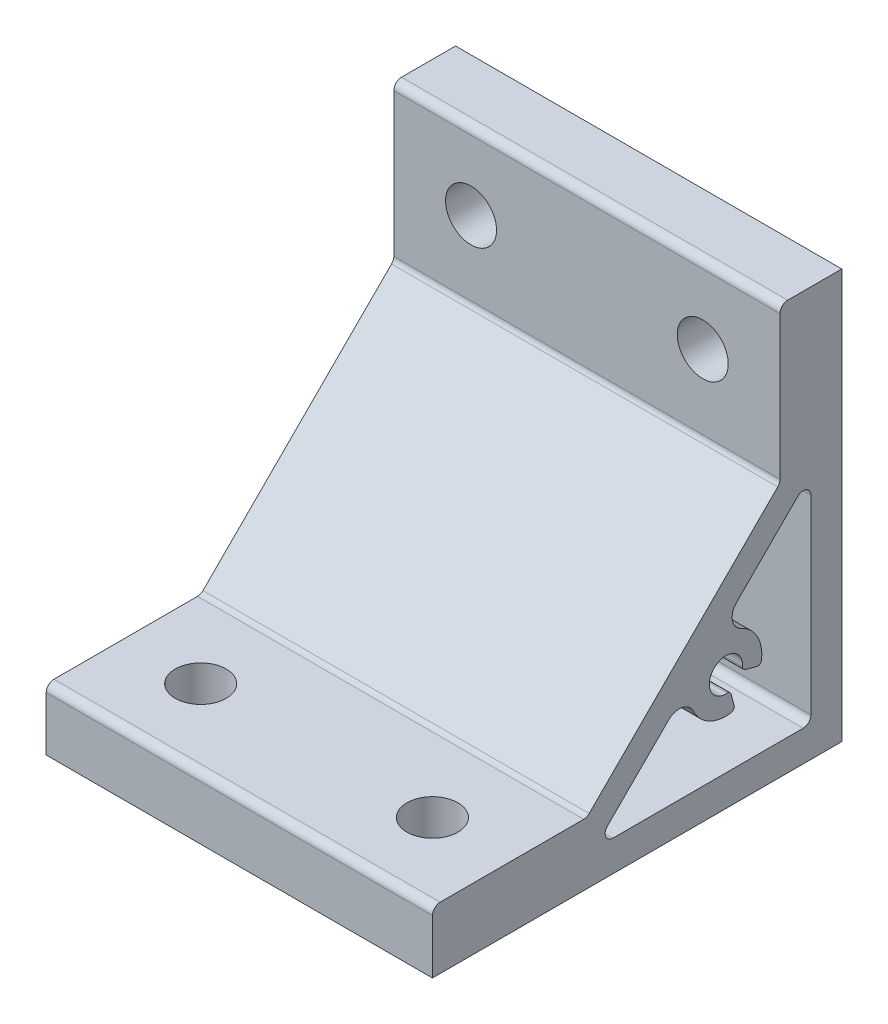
SolidWorks part; units mm, degrees
ref_plane "正面" through (0, 0, 0) normal (0, 0, 1) x (1, 0, 0)
ref_plane "平面" through (0, 0, 0) normal (0, 1, 0) x (1, 0, 0)
ref_plane "右側面" through (0, 0, 0) normal (1, 0, 0) x (0, 0, -1)
sketch "ｽｹｯﾁ1" plane through (0, 0, 0) normal (1, 0, 0) x (0, 0, -1)
  line L17 (-53, 0) -> (0, 0)
  line L18 (-52, 8) -> (-33.4142, 8)
  line L19 (-53, 0) -> (-53, 7)
  line L20 (-8, 33.4142) -> (-8, 52)
  line L21 (0, 0) -> (0, 53)
  line L22 (-8.2929, 32.7071) -> (-32.7071, 8.2929)
  line L23 (-7, 53) -> (0, 53)
  line L25 (-29.636, 4) -> (-5, 4)
  line L26 (-20.453, 15) -> (-9.6217, 15) construction
  line L31 (-22.4428, 13.6074) -> (-30.3431, 5.7071)
  line L33 (-4, 5) -> (-4, 29.636)
  line L34 (-15, 9.5192) -> (-15, 20.4496) construction
  line L35 (-11.0206, 13.9337) -> (-12.4863, 14.3264)
  line L36 (-13.9337, 11.0206) -> (-14.3264, 12.4863)
  line L37 (-5.7071, 30.3431) -> (-13.6074, 22.4428)
  arc A16 (-52, 8) -> (-53, 7) centre (-52, 7) ccw
  arc A17 (-33.4142, 8) -> (-32.7071, 8.2929) centre (-33.4142, 9) ccw
  arc A18 (-8.2929, 32.7071) -> (-8, 33.4142) centre (-9, 33.4142) ccw
  arc A19 (-7, 53) -> (-8, 52) centre (-7, 52) ccw
  arc A20 (-19.2155, 13.0373) -> (-14.3464, 10.3962) centre (-15, 15) ccw
  arc A22 (-19.2155, 13.0373) -> (-22.4428, 13.6074) centre (-21.0286, 12.1932) ccw
  arc A23 (-30.3431, 5.7071) -> (-29.636, 4) centre (-29.636, 5) ccw
  arc A25 (-4, 29.636) -> (-5.7071, 30.3431) centre (-5, 29.636) ccw
  arc A26 (-12.8556, 14.8454) -> (-14.8454, 12.8556) centre (-15, 15) ccw
  arc A27 (-11.0206, 13.9337) -> (-10.3962, 14.3464) centre (-10.8912, 14.4167) ccw
  arc A28 (-14.3464, 10.3962) -> (-13.9337, 11.0206) centre (-14.4167, 10.8912) ccw
  arc A29 (-14.3264, 12.4863) -> (-14.8454, 12.8556) centre (-14.8094, 12.3569) ccw
  arc A30 (-5, 4) -> (-4, 5) centre (-5, 5) ccw
  arc A31 (-13.6074, 22.4428) -> (-13.0373, 19.2155) centre (-12.1932, 21.0286) ccw
  arc A32 (-10.3962, 14.3464) -> (-13.0373, 19.2155) centre (-15, 15) ccw
  arc A33 (-12.8556, 14.8454) -> (-12.4863, 14.3264) centre (-12.3569, 14.8094) ccw
  dimension "D1" = 53
  dimension "D2" = 53
  dimension "D3" = 8
  dimension "D4" = 8
extrude "押し出し1" add sketch "ｽｹｯﾁ1" along normal mid plane 50
sketch "ｽｹｯﾁ2" plane through (0, 0, 8) normal (0, 0, 1) x (1, 0, 0)
  line L3 (-25, 52) -> (-25, 33.4142) construction
  line L4 (25, 52) -> (25, 33.4142) construction
  line L5 (25, 53) -> (-25, 53) construction
  circle A0 centre (15, 43) radius 3.3
  circle A1 centre (-15, 43) radius 3.3
  dimension "D1" = 10
  dimension "D3" = 10
  dimension "D2" = 10
  dimension "D4" = 10
extrude "ｶｯﾄ - 押し出し1" cut sketch "ｽｹｯﾁ2" against normal through all
sketch "ｽｹｯﾁ3" plane through (0, 8, 0) normal (0, 1, 0) x (-1, 0, 0)
  line L3 (25, 33.4142) -> (25, 52) construction
  line L4 (-25, 33.4142) -> (-25, 52) construction
  line L5 (-25, 53) -> (25, 53) construction
  circle A0 centre (-15, 43) radius 3.3
  circle A1 centre (15, 43) radius 3.3
  dimension "D1" = 10
  dimension "D3" = 10
  dimension "D2" = 10
  dimension "D4" = 10
extrude "ｶｯﾄ - 押し出し2" cut sketch "ｽｹｯﾁ3" against normal through all
